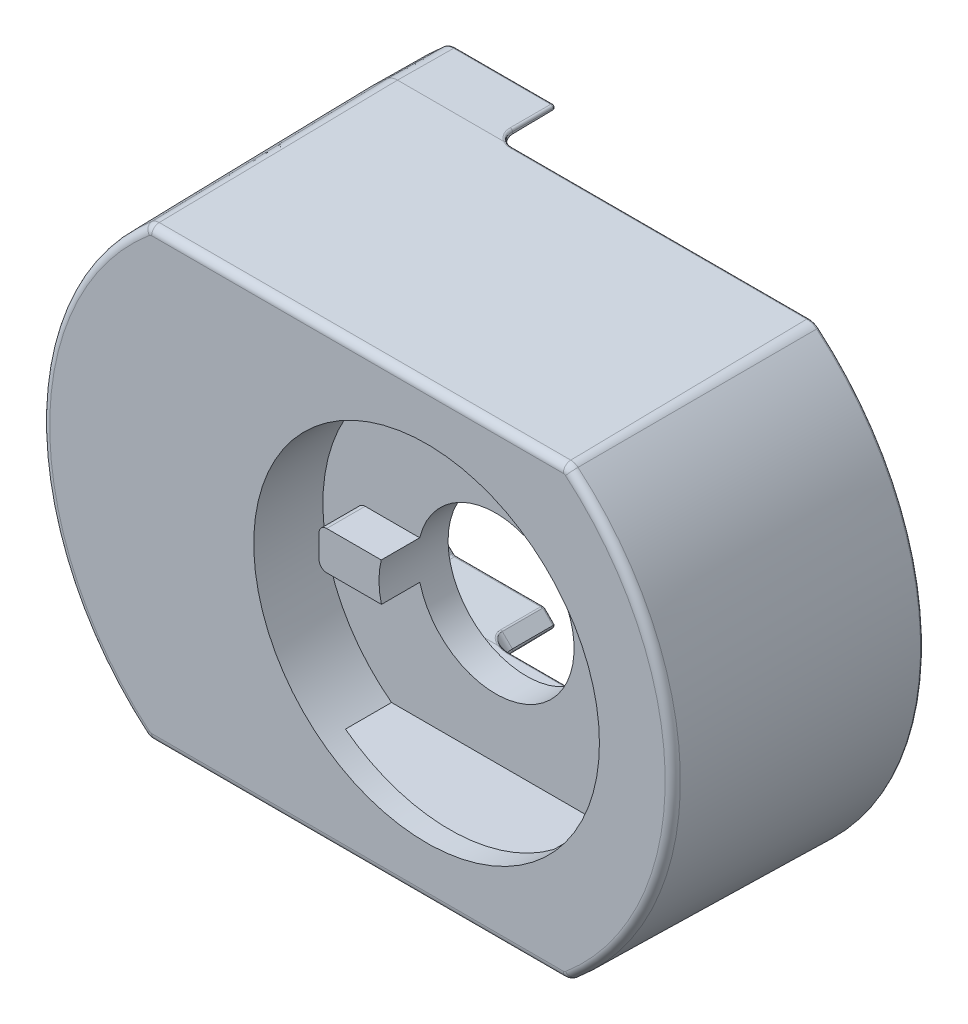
SolidWorks part; units mm, degrees
ref_plane "Płaszczyzna przednia" through (0, 0, 0) normal (0, 0, 1) x (1, 0, 0)
ref_plane "Płaszczyzna górna" through (0, 0, 0) normal (0, 1, 0) x (1, 0, 0)
ref_plane "Płaszczyzna prawa" through (0, 0, 0) normal (1, 0, 0) x (0, 0, -1)
sketch "Szkic1" plane through (0, 0, 0) normal (0, 0, 1) x (1, 0, 0)
  line L2 (-13.3938, -14.1) -> (13.3938, -14.1) construction
  line L4 (-20.1, 0) -> (20.1, 0) construction
  line L5 (-13.3938, 14.1) -> (13.3938, 14.1) construction
  line L6 (-13.3938, -14.8) -> (13.3938, -14.8)
  line L7 (-13.3938, 14.8) -> (13.3938, 14.8)
  arc A1 (-13.5873, 14.0292) -> (-13.5873, -14.0292) centre (-1.7333, 0) ccw construction
  arc A2 (-13.5873, -14.0292) -> (-13.3938, -14.1) centre (-13.3938, -13.8002) ccw construction
  arc A3 (13.3938, -14.1) -> (13.5873, -14.0292) centre (13.3938, -13.8002) ccw construction
  arc A4 (13.5873, -14.0292) -> (13.5873, 14.0292) centre (1.7333, 0) ccw construction
  arc A6 (13.3938, 14.1) -> (13.5873, 14.0292) centre (13.3938, 13.8002) cw construction
  arc A7 (-13.5873, 14.0292) -> (-13.3938, 14.1) centre (-13.3938, 13.8002) cw construction
  arc A8 (-14.0391, 14.5639) -> (-14.0391, -14.5639) centre (-1.7333, 0) ccw
  arc A9 (-14.0391, -14.5639) -> (-13.3938, -14.8) centre (-13.3938, -13.8002) ccw
  arc A10 (13.3938, -14.8) -> (14.0391, -14.5639) centre (13.3938, -13.8002) ccw
  arc A11 (14.0391, -14.5639) -> (14.0391, 14.5639) centre (1.7333, 0) ccw
  arc A12 (13.3938, 14.8) -> (14.0391, 14.5639) centre (13.3938, 13.8002) cw
  arc A13 (-14.0391, 14.5639) -> (-13.3938, 14.8) centre (-13.3938, 13.8002) cw
  dimension "D1" = 0.7
extrude "Dodanie-wyciągnięcie1" add sketch "Szkic1" along normal blind 16 draft 1
sketch "Szkic3" plane through (0, 0, 16) normal (0, 0, 1) x (1, 0, 0)
  line L0 (0, 14.5207) -> (0, -14.5207) construction
  line L1 (13.3938, 14.5207) -> (-13.3938, 14.5207) construction
  line L2 (-13.3938, -14.5207) -> (13.3938, -14.5207) construction
  line L3 (0, 0) -> (4.5, 0) construction
  circle A0 centre (4.5, 0) radius 4.5 construction
  circle A1 centre (4.5, 0) radius 11.25
extrude "Wytnij-wyciągnięcie1" cut sketch "Szkic3" against normal blind 4.5
sketch "Szkic5" plane through (0, 0, 0) normal (0, 0, -1) x (-1, 0, 0)
  line L10 (-13.0219, 12.8) -> (13.0219, 12.8)
  line L11 (-13.0219, -12.8) -> (13.0219, -12.8)
  arc A67 (-12.7483, 13.0362) -> (-12.7483, -13.0362) centre (-1.7333, 0) ccw
  arc A68 (-13.0219, 12.8) -> (-13.0219, -12.8) centre (-1.7333, 0) ccw
  arc A70 (12.7483, -13.0362) -> (12.7483, 13.0362) centre (1.7333, 0) ccw
  arc A71 (13.0219, -12.8) -> (13.0219, 12.8) centre (1.7333, 0) ccw
  dimension "D4" = 2
  dimension "D5" = 2
extrude "Wytnij-wyciągnięcie3" cut sketch "Szkic5" against normal blind 14.5
sketch "Szkic6" plane through (0, 0, 16) normal (0, 0, 1) x (1, 0, 0)
  circle A0 centre (4.5, 0) radius 11.25
  circle A1 centre (4.5, 0) radius 12.75
  dimension "D1" = 1.5
extrude "Dodanie-wyciągnięcie3" add sketch "Szkic6" against normal blind 4.5
sketch "Szkic7" plane through (0, 0, 11.5) normal (0, 0, -1) x (-1, 0, 0)
  circle A0 centre (-4.5, 0) radius 12.75
  circle A1 centre (-4.5, 0) radius 5.1
  circle A2 centre (-4.5, 0) radius 12.75 construction
  dimension "D1" = 10.2
extrude "Dodanie-wyciągnięcie4" add sketch "Szkic7" along normal blind 2
sketch "Szkic9" plane through (0, 0, 0) normal (0, 0, -1) x (-1, 0, 0)
  line L1 (-13.555, -8.976) -> (4.5551, -8.976)
  line L3 (-13.8909, 8.624) -> (4.8909, 8.624)
  arc A0 (4.8909, 8.624) -> (-13.8909, 8.624) centre (-4.5, 0) ccw
  arc A1 (-13.555, -8.976) -> (4.5551, -8.976) centre (-4.5, 0) ccw
  circle A4 centre (-4.5, 0) radius 12.75 construction
  dimension "D1" = 17.6
extrude "Wytnij-wyciągnięcie4" cut sketch "Szkic9" against normal up to surface (14.5 mm away)
sketch "Szkic10" plane through (0, 0, 11.5) normal (0, 0, 1) x (1, 0, 0)
  line L2 (-4.5, -1.275) -> (-4.5, 1.225)
  line L4 (-4.5, 1.225) -> (-0.4507, 1.225)
  line L5 (-4.5, -1.275) -> (-0.4381, -1.275)
  circle A0 centre (4.5, 0) radius 5.1 construction
  arc A1 (-0.4507, 1.225) -> (-0.4381, -1.275) centre (4.5, 0) ccw
  circle A2 centre (4.5, 0) radius 11 construction
  circle A3 centre (4.5, 0) radius 9.5 construction
  point P0 (-0.6, 0)
  dimension "D2" = 1.5
  dimension "D4" = 5.1
  dimension "D1" = 2.5
  dimension "D3" = 9
extrude "Dodanie-wyciągnięcie5" add sketch "Szkic10" along normal blind 2.5
fillet "Zaokrąglenie1" radius 0.5 2 edges at (-4.5, -1.275, 12.75) (-4.5, 1.225, 12.75)
sketch "Szkic11" plane through (0, 0, 14.5) normal (0, 0, -1) x (-1, 0, 0)
  circle A0 centre (11, 0) radius 3
  circle A1 centre (-4.5, 0) radius 5.1 construction
  dimension "D1" = 15.5
extrude "Dodanie-wyciągnięcie6" add sketch "Szkic11" along normal blind 8 draft 1
ref_plane "Płaszczyzna1" through (0, 0, 15.5) normal (0, 0, 1) x (1, 0, 0)
sketch "Szkic14" plane through (0, 0, 15.5) normal (0, 0, 1) x (1, 0, 0)
  circle A0 centre (-11, 0) radius 1.2
  dimension "D1" = 2.4
extrude "Wytnij-wyciągnięcie5" cut sketch "Szkic14" against normal blind 12 draft 1
sketch "Szkic16" plane through (0, 0, 0) normal (0, 0, -1) x (-1, 0, 0)
  line L2 (13.3019, 13.8) -> (-13.3019, 13.8)
  line L3 (-13.3019, -13.8) -> (13.3019, -13.8)
  arc A7 (-13.4642, 13.7401) -> (-13.4642, -13.7401) centre (-1.7333, 0) ccw
  arc A10 (13.4642, -13.7401) -> (13.4642, 13.7401) centre (1.7333, 0) ccw
  arc A18 (13.3019, -13.8) -> (13.4642, -13.7401) centre (13.3019, -13.55) ccw
  arc A19 (13.3019, 13.8) -> (13.4642, 13.7401) centre (13.3019, 13.55) cw
  arc A20 (-13.3019, 13.8) -> (-13.4642, 13.7401) centre (-13.3019, 13.55) ccw
  arc A21 (-13.4642, -13.7401) -> (-13.3019, -13.8) centre (-13.3019, -13.55) ccw
  dimension "D1" = 0.25
extrude "Wytnij-wyciągnięcie6" cut sketch "Szkic16" against normal blind 2
fillet "Zaokrąglenie2" radius 0.5 8 edges at (13.6414, 14.4768, 16) (20.5207, 0, 16) (13.6414, -14.4768, 16) (0, -14.5207, 16) (-13.6414, -14.4768, 16) (-20.5207, 0, 16) (-13.6414, 14.4768, 16) (0, 14.5207, 16)
fillet "Zaokrąglenie7" radius 0.5 8 edges at (0, -12.8, 14.5) (-18.8, 0, 14.5) (18.8, 0, 14.5) (0, 12.8, 14.5) (13.0219, 12.8, 8.25) (-13.0219, 12.8, 8.25) (-13.0219, -12.8, 8.25) (13.0219, -12.8, 8.25)
fillet "Zaokrąglenie8" radius 0.5 2 edges
sketch "Szkic17" plane through (0, 0, 0) normal (0, 0, -1) x (-1, 0, 0)
  line L0 (13.3938, 14.8) -> (6.8938, 14.8)
  line L2 (6.8938, 14.8) -> (6.8938, 13.8)
  line L5 (6.8938, -14.8) -> (6.8938, -13.8)
  line L14 (6.8938, 13.8) -> (13.3019, 13.8)
  line L15 (13.3938, -14.8) -> (6.8938, -14.8)
  line L19 (6.8938, -13.8) -> (13.3019, -13.8)
  arc A8 (14.039, -14.5639) -> (13.3938, -14.8) centre (13.3938, -13.8002) cw
  arc A9 (13.4642, -13.7401) -> (13.3019, -13.8) centre (13.3019, -13.55) cw
  arc A10 (13.4642, 13.7401) -> (13.3019, 13.8) centre (13.3018, 13.55) ccw
  arc A11 (14.039, 14.5639) -> (13.3938, 14.8) centre (13.3937, 13.8002) ccw
  arc A12 (13.4642, -13.7401) -> (13.4642, 13.7401) centre (1.7333, 0) ccw
  arc A13 (14.039, 14.5639) -> (14.039, -14.5639) centre (1.7333, 0) cw
extrude "Dodanie-wyciągnięcie7" add sketch "Szkic17" along normal blind 3.8 draft 0.5
chamfer "Sfazowanie1" distance 0.7 angle 45 2 edges at (-6.9104, 13.8166, -1.9) (-6.9104, -13.8166, -1.9)
fillet "Zaokrąglenie9" radius 1 4 edges at (-6.8938, -14.65, 0) (-7.2438, -14.15, 0) (-6.8938, 14.65, 0) (-7.2438, 14.15, 0)
fillet "Zaokrąglenie11" radius 0.2 5 edges at (-13.3998, 13.8157, -3.8) (-10.4644, 13.8332, -3.8) (-10.4644, -13.8332, -3.8) (-13.3998, -13.8157, -3.8) (-19.8331, 0, -3.8)
fillet "Zaokrąglenie13" radius 0.15 29 edges at (-7.1778, 14.2823, -3.8) (-7.5685, 13.8906, -3.742) (3.5525, 13.8, 0) (13.3884, 13.7846, 0) (19.8, 0, 0) (13.3884, -13.7846, 0) (3.5524, -13.8, 0) (-7.5685, -13.8906, -3.742) (-6.6065, -14.7975, -0.2898) (-10.1604, -14.7668, -3.8) (-13.7259, -14.708, -3.8) (-20.7668, 0, -3.8) (-13.7259, 14.708, -3.8) (-6.6065, 14.7975, -0.2898) (3.7457, -14.8, 0) (13.7373, -14.7391, 0) (20.8, 0, 0) (13.7373, 14.7391, 0) (-7.1778, -14.2823, -3.8) (-6.9269, -14.65, -3.8) (-6.9147, -14.7791, -2.3956) (-6.9269, 14.65, -3.8) (-10.1604, 14.7668, -3.8) (-6.9147, 14.7791, -2.3956) (3.7457, 14.8, 0) (-7.1883, 13.8025, -0.2885) (-7.1882, -13.8025, -0.2885) (-7.6138, -13.82, -2.2947) (-7.6139, 13.82, -2.2947)
